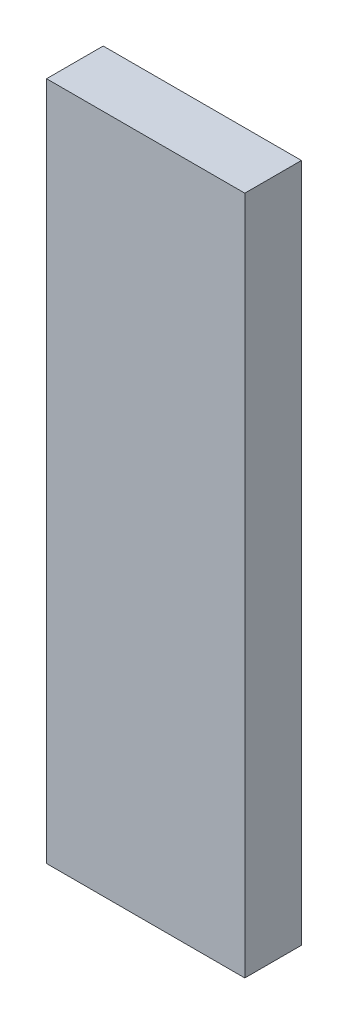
SolidWorks part; units mm, degrees
ref_plane "Front Plane" through (0, 0, 0) normal (0, 0, 1) x (1, 0, 0)
ref_plane "Top Plane" through (0, 0, 0) normal (0, 1, 0) x (1, 0, 0)
ref_plane "Right Plane" through (0, 0, 0) normal (1, 0, 0) x (0, 0, -1)
sketch "Sketch1" plane through (0, 0, 0) normal (0, 1, 0) x (1, 0, 0)
  line L1 (-66.675, 19.05) -> (66.675, 19.05)
  line L2 (-66.675, 19.05) -> (-66.675, -19.05)
  line L3 (-66.675, -19.05) -> (66.675, -19.05)
  line L4 (66.675, 19.05) -> (66.675, -19.05)
  line L5 (-66.675, 19.05) -> (66.675, -19.05) construction
  line L6 (-66.675, -19.05) -> (66.675, 19.05) construction
  point P0 (0, 0)
  dimension "D1" = 133.35
  dimension "D2" = 38.1
extrude "Boss-Extrude1" add sketch "Sketch1" along normal blind 457.2
hole_wizard "CSK for #8 Flat Head Machine Screw (100)2" positions "Sketch5" profile "Sketch4" countersink size "#8" standard "ANSI Inch"
sketch "Sketch5" plane through (0, 0, -19.05) normal (0, 0, -1) x (-1, 0, 0)
  line L0 (0, 457.2) -> (0, 0) construction
  line L1 (-69.85, 457.2) -> (69.85, 457.2) construction
  line L2 (-69.85, 0) -> (69.85, 0) construction
  line L4 (69.85, 228.6) -> (-69.85, 228.6) construction
  line L5 (69.85, 457.2) -> (69.85, 0) construction
  line L6 (-69.85, 457.2) -> (-69.85, 0) construction
  point P0 (44.45, 228.6)
  point P2 (0, 228.6)
  point P4 (-44.45, 228.6)
  dimension "D1" = 25.4
  dimension "D2" = 25.4
sketch "Sketch4" plane through (-44.45, 228.6, -19.05) normal (1, 0, 0) x (0, 1, 0)
  line L0 (0, 0) -> (0, 38.1)
  line L1 (0, 38.1) -> (2.2479, 38.1)
  line L2 (2.2479, 38.1) -> (2.2479, 1.6518)
  line L3 (2.2479, 1.6518) -> (4.2164, 0)
  line L5 (4.2164, 0) -> (0, 0)
  line L6 (-2.2479, 1.6518) -> (-4.2164, 0) construction
  line L11 (0, -6.35) -> (0, 107.95) construction
  dimension "Thru Hole Dia." = 4.4958
  dimension "Thru Hole Depth" = 38.1
  dimension "Near C'Sink Dia." = 8.4328
  dimension "Near C'Sink Angle" = 100
sketch "Sketch6" plane through (0, 457.2, 0) normal (0, 1, 0) x (1, 0, 0)
  line L0 (66.675, -19.05) -> (59.9569, 19.05)
  line L5 (66.675, 19.05) -> (-66.675, 19.05) construction
  line L6 (66.675, 19.05) -> (66.675, -19.05)
  line L7 (59.9569, 19.05) -> (66.675, 19.05)
  dimension "D1" = 10
extrude "Cut-Extrude2" [suppressed] cut sketch "Sketch6" against normal through all
